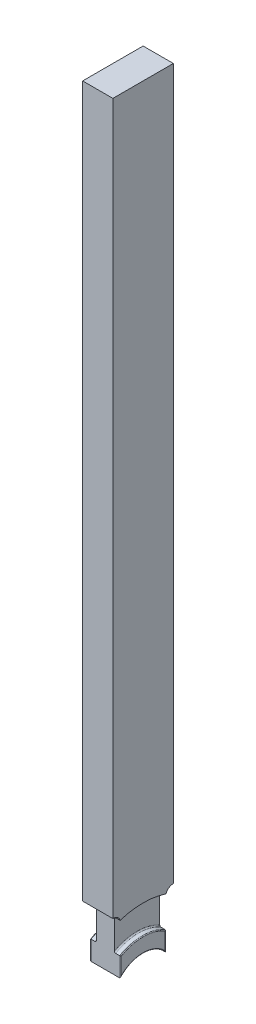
SolidWorks part; units mm, degrees
ref_plane "Front Plane" through (0, 0, 0) normal (0, 0, 1) x (1, 0, 0)
ref_plane "Top Plane" through (0, 0, 0) normal (0, 1, 0) x (1, 0, 0)
ref_plane "Right Plane" through (0, 0, 0) normal (1, 0, 0) x (0, 0, -1)
sketch "Sketch1" plane through (0, 0, 0) normal (1, 0, 0) x (0, 0, -1)
  line L0 (-10, 260) -> (-10, 0)
  line L1 (0, 249.2329) -> (0, 0) construction
  line L2 (10, 260) -> (10, 0)
  line L3 (-10, 260) -> (10, 260)
  line L6 (-10, 0) -> (10, 0)
  arc A0 (-10, 0) -> (10, 0) centre (0, 0) cw construction
  dimension "R" = 10
  dimension "L" = 250
  dimension "T" = 20
extrude "Boss-Extrude1" add sketch "Sketch1" along normal mid plane 10
sketch "Sketch8" plane through (0, 0, 0) normal (1, 0, 0) x (0, 0, -1)
  circle A0 centre (0, 0) radius 10
  arc A1 (10, 0) -> (-10, 0) centre (0, 0) ccw construction
extrude "Cut-Extrude4" cut sketch "Sketch8" against normal through all both and the other way through all
sketch "Sketch2" plane through (0, 0, 0) normal (0, 0, 1) x (1, 0, 0)
  line L0 (5, 15) -> (3, 15)
  line L1 (5, 260) -> (5, 0) construction
  line L2 (3, 15) -> (3, 24.5)
  line L3 (3, 24.5) -> (5, 24.5)
  line L4 (5, 24.5) -> (5, 15)
  line L5 (0, 29.9173) -> (0, 0) construction
  line L6 (-5, 24.5) -> (-5, 15)
  line L7 (-3, 24.5) -> (-5, 24.5)
  line L8 (-3, 15) -> (-3, 24.5)
  line L9 (-5, 15) -> (-3, 15)
  line L10 (-8.8482, 0) -> (24.5305, 0) construction
  dimension "D1" = 6
  dimension "D2" = 24.5
  dimension "D3" = 15
revolve "Cut-Revolve1" cut sketch "Sketch2" angle 360 about L10
sketch "Sketch6" plane through (0, 0, 0) normal (1, 0, 0) x (0, 0, -1)
  line L0 (0, 19.903) -> (0, 0) construction
  line L1 (7.5, 0) -> (26.55, 0)
  line L2 (7.5, 0) -> (7.5, 22.6124)
  line L3 (9.8876, 25) -> (26.55, 25)
  line L4 (26.55, 0) -> (26.55, 25)
  line L9 (-7.5, 0) -> (-26.55, 0)
  line L10 (-26.55, 0) -> (-26.55, 25)
  line L11 (-9.8876, 25) -> (-26.55, 25)
  line L12 (-7.5, 0) -> (-7.5, 22.6124)
  arc A0 (7.5, 22.6124) -> (9.8876, 25) centre (9.8876, 22.6124) cw
  arc A1 (-7.5, 22.6124) -> (-9.8876, 25) centre (-9.8876, 22.6124) ccw
  dimension "D3" = 2.3876
  dimension "D1" = 25
  dimension "MT" = 15
  dimension "D2" = 19.05
extrude "Cut-Extrude2" cut sketch "Sketch6" against normal through all both and the other way through all
fillet "Fillet1" radius 0.762 2 edges at (-3, 24.5, 0) (3, 24.5, 0)
fillet "Fillet2" radius 0.381 2 edges at (-3, 15, 0) (3, 15, 0)
fillet "Fillet3" radius 0.25 8 edges at (5, 9.8024, 7.5) (5, 15, 0) (5, 9.8024, -7.5) (5, 10, 0) (-5, 15, 0) (-5, 9.8024, 7.5) (-5, 10, 0) (-5, 9.8024, -7.5)
